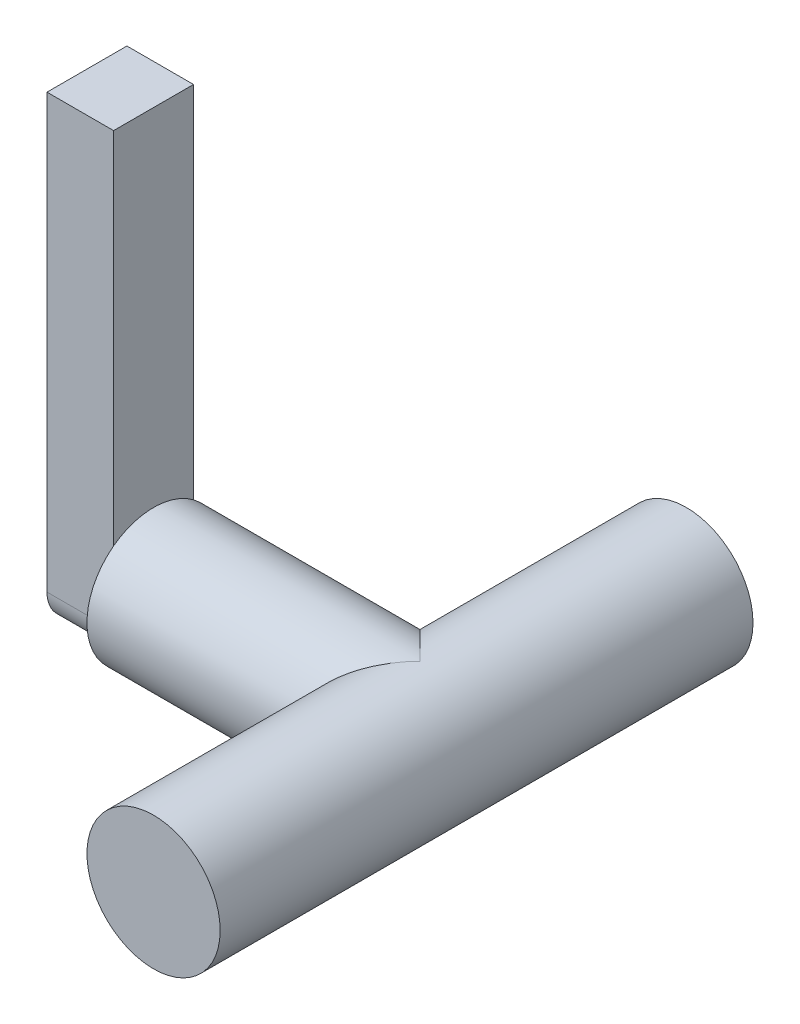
SolidWorks part; units mm, degrees
ref_plane "Front Plane" through (0, 0, 0) normal (0, 0, 1) x (1, 0, 0)
ref_plane "Top Plane" through (0, 0, 0) normal (0, 1, 0) x (1, 0, 0)
ref_plane "Right Plane" through (0, 0, 0) normal (1, 0, 0) x (0, 0, -1)
sketch "Sketch1" plane through (0, 0, 0) normal (0, 0, 1) x (1, 0, 0)
  circle A1 centre (-57.15, 50.8) radius 6.35
extrude "Extrude1" add sketch "Sketch1" along normal blind 50.8
ref_plane "Plane1" through (-57.15, 0, 0) normal (1, 0, 0) x (0, 0, -1)
sketch "Sketch2" plane through (-57.15, 0, 0) normal (1, 0, 0) x (0, 0, -1)
  line L0 (-50.8, 50.8) -> (-25.4, 50.8) construction
  line L1 (-50.8, 57.15) -> (-50.8, 44.45) construction
  line L2 (-25.4, 50.8) -> (0, 50.8) construction
  line L3 (0, 44.45) -> (0, 57.15) construction
  line L4 (-50.8, 44.45) -> (0, 44.45) construction
  circle A0 centre (-25.4, 50.8) radius 6.35
extrude "Extrude2" add sketch "Sketch2" against normal blind 25.4
sketch "Sketch3" plane through (-82.55, 0, 0) normal (-1, 0, 0) x (0, 0, 1)
  line L1 (21.59, 45.72) -> (29.21, 45.72)
  line L2 (21.59, 45.72) -> (21.59, 90.17)
  line L3 (21.59, 90.17) -> (29.21, 90.17)
  line L4 (29.21, 45.72) -> (29.21, 90.17)
  circle A0 centre (25.4, 50.8) radius 6.35 construction
  dimension "D1" = 7.62
  dimension "D2" = 44.45
extrude "Extrude3" add sketch "Sketch3" along normal blind 6.35
fillet "Fillet1" radius 3.175 2 edges at (-85.725, 45.72, 29.21) (-85.725, 45.72, 21.59)
